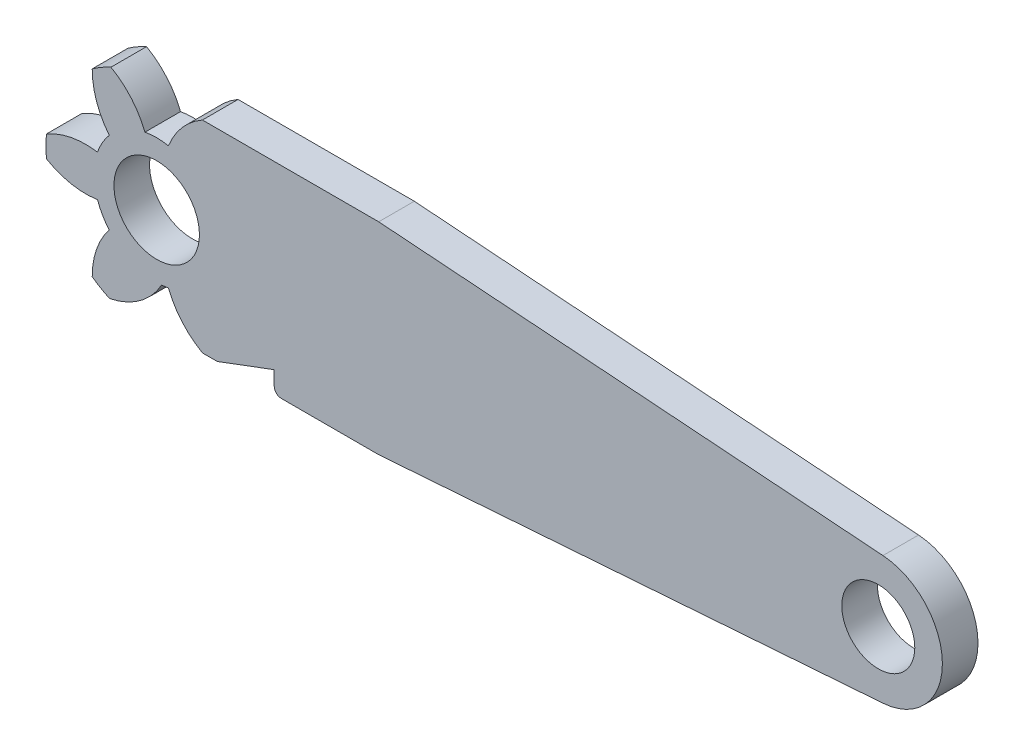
SolidWorks part; units mm, degrees
ref_plane "Plan1" through (0, 0, 0) normal (0, 0, 1) x (1, 0, 0)
ref_plane "Plan2" through (0, 0, 0) normal (0, 1, 0) x (1, 0, 0)
ref_plane "Plan3" through (0, 0, 0) normal (1, 0, 0) x (0, 0, -1)
sketch "Esquisse1" plane through (0, 0, 0) normal (0, 0, 1) x (1, 0, 0)
  line L0 (99.3801, 197.6714) -> (91.3801, 194.6714)
  line L1 (89.3002, 194.6714) -> (91.3801, 194.6714)
  line L2 (114.0488, 222.9891) -> (89.3002, 222.9901)
  line L3 (114.0488, 194.6714) -> (184.8418, 199.8543)
  line L4 (114.0488, 222.9891) -> (184.8418, 217.8062)
  line L5 (99.3801, 196.9499) -> (99.3801, 195.6714)
  line L6 (99.3801, 197.6714) -> (99.3801, 196.9499)
  line L7 (100.3801, 194.6714) -> (114.0488, 194.6714)
  arc A0 (184.8418, 199.8543) -> (184.8418, 217.8062) centre (184.1846, 208.8303) ccw
  arc A1 (81.2262, 217.4715) -> (76.4574, 222.9901) centre (71.0444, 213.4927) ccw
  arc A2 (76.2562, 194.7644) -> (83.576, 200.061) centre (74.1654, 205.3601) ccw
  circle A3 centre (82.8788, 208.8307) radius 6
  arc A4 (84.5314, 217.4715) -> (81.2262, 217.4715) centre (82.8788, 208.8307) ccw
  arc A5 (83.576, 200.061) -> (84.5314, 200.1899) centre (82.8788, 208.8307) ccw
  arc A6 (89.3002, 222.9901) -> (84.5314, 217.4715) centre (94.7132, 213.4927) ccw
  arc A7 (84.5314, 200.1899) -> (89.3002, 194.6714) centre (94.7132, 204.1688) ccw
  arc A8 (74.5694, 205.9415) -> (76.2219, 203.0792) centre (82.8788, 208.8307) ccw
  arc A9 (76.4574, 222.9901) -> (73.8272, 221.4715) centre (82.8788, 208.8307) ccw
  arc A10 (73.8272, 196.19) -> (76.2562, 194.7644) centre (82.8788, 208.8307) ccw
  arc A11 (73.8272, 221.4715) -> (76.2219, 214.5823) centre (84.7586, 221.4106) ccw
  arc A12 (76.2219, 203.0792) -> (73.8272, 196.19) centre (84.7586, 196.2509) ccw
  arc A13 (74.5694, 211.72) -> (67.4057, 210.3493) centre (72.9242, 200.9128) ccw
  arc A14 (67.4057, 207.3122) -> (74.5694, 205.9415) centre (72.9242, 216.7486) ccw
  arc A15 (76.2219, 214.5823) -> (74.5694, 211.72) centre (82.8788, 208.8307) ccw
  arc A16 (67.4057, 210.3493) -> (67.4057, 207.3122) centre (82.8788, 208.8307) ccw
  circle A17 centre (184.1846, 208.8303) radius 5.125
  arc A18 (99.3801, 195.6714) -> (100.3801, 194.6714) centre (100.3801, 195.6714) ccw
  dimension "D1" = 8.7974
  dimension "D2" = 9.3792
  dimension "D3" = 3.4707
  dimension "D4" = 10.8
  dimension "D5" = 101.3058
extrude "Base-Extrusion" add sketch "Esquisse1" along normal blind 5
thread "Filetage1" pitch 1.75 start angle 0, offset 3, length 10, pitch 1.75, diameter 10.25
ref_plane "Plan4" through (179.0596, 208.8303, 8) normal (0, -1, 0) x (-1, 0, 0)
sketch "Profil de filetage1" plane through (179.0596, 208.8303, 8) normal (0, -1, 0) x (-1, 0, 0)
  line L0 (0, 0) -> (0, 1.75) construction
  line L1 (0, 0) -> (0.9472, 0.5469)
  line L2 (0.9472, 0.5469) -> (0.9472, 0.7656)
  line L3 (0.9472, 0.7656) -> (0, 1.3125)
  line L4 (0.9472, 0.6562) -> (0, 0.6562) construction
  line L11 (0, 0) -> (0, 1.3125)
  point P2 (0, 0)
  dimension "Pitch" = 1.75
  dimension "Profile_Angle" = 60
  dimension "Profile_Land" = 0.2188
  dimension "Profile_Height" = 0.9472
